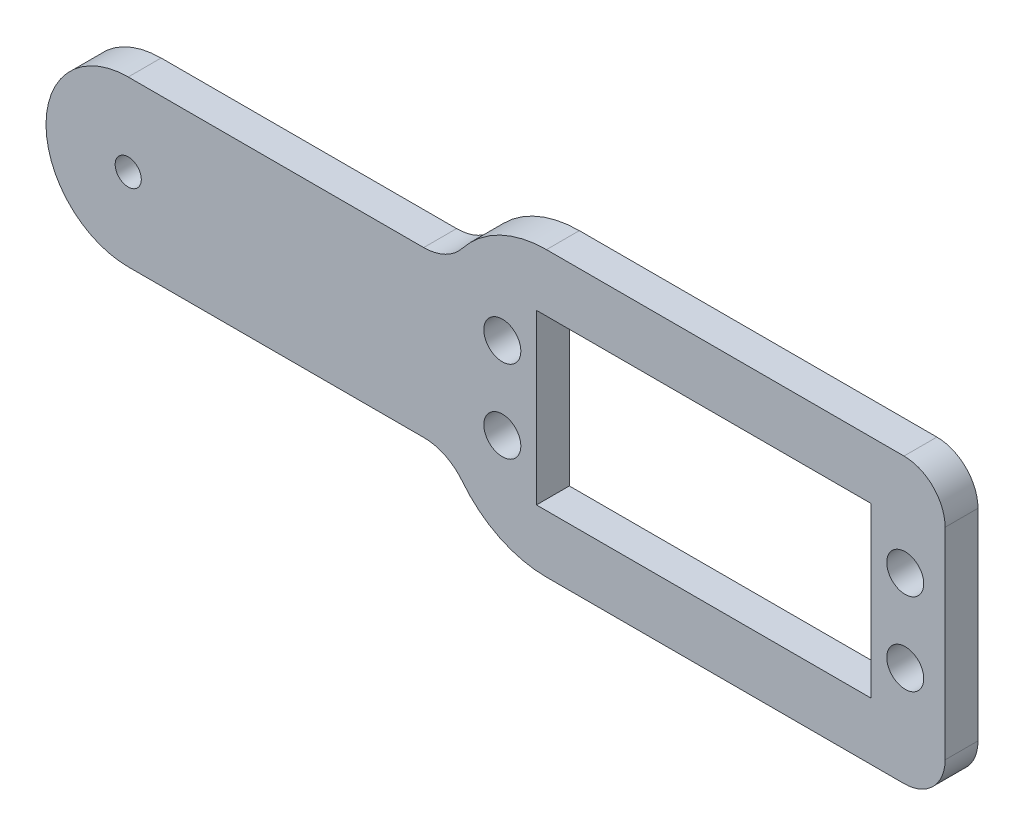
SolidWorks part; units mm, degrees
ref_plane "Front Plane" through (0, 0, 0) normal (0, 0, 1) x (1, 0, 0)
ref_plane "Top Plane" through (0, 0, 0) normal (0, 1, 0) x (1, 0, 0)
ref_plane "Right Plane" through (0, 0, 0) normal (1, 0, 0) x (0, 0, -1)
sketch "Sketch1" plane through (0, 0, 0) normal (0, 0, 1) x (1, 0, 0)
  line L0 (-80, 0) -> (29.35, 0) construction
  line L1 (29.35, -12.25) -> (29.35, 12.25)
  line L2 (24.35, 17.25) -> (-19.134, 17.25)
  line L3 (-34.0651, 10) -> (-70, 10)
  line L4 (-34.0651, -10) -> (-70, -10)
  line L5 (24.35, -17.25) -> (-19.134, -17.25)
  line L32 (-24.5, -5) -> (24.5, 5) construction
  line L33 (20.35, 10.25) -> (-20.35, 10.25)
  line L34 (20.35, 10.25) -> (20.35, -10.25)
  line L35 (20.35, -10.25) -> (-20.35, -10.25)
  line L36 (-20.35, 10.25) -> (-20.35, -10.25)
  line L37 (20.35, 10.25) -> (-20.35, -10.25) construction
  line L38 (20.35, -10.25) -> (-20.35, 10.25) construction
  arc A0 (-29.35, -12.2895) -> (-34.0651, -10) centre (-34.0651, -16) ccw
  arc A1 (29.35, 12.25) -> (24.35, 17.25) centre (24.35, 12.25) ccw
  arc A2 (-19.134, 17.25) -> (-29.35, 12.2895) centre (-19.134, 4.25) ccw
  arc A3 (-29.35, 12.2895) -> (-34.0651, 10) centre (-34.0651, 16) cw
  arc A4 (-70, 10) -> (-70, -10) centre (-70, 0) ccw
  arc A5 (-19.134, -17.25) -> (-29.35, -12.2895) centre (-19.134, -4.25) cw
  arc A6 (29.35, -12.25) -> (24.35, -17.25) centre (24.35, -12.25) cw
  circle A7 centre (-70, 0) radius 1.59
  circle A23 centre (-24.5, -5) radius 2.25
  circle A24 centre (24.5, -5) radius 2.25
  circle A25 centre (24.5, 5) radius 2.25
  circle A26 centre (-24.5, 5) radius 2.25
  point P0 (0, 0)
  point P36 (-70, 0)
  point P92 (0, 0)
  dimension "D5" = 4.5
  dimension "D6" = 5
  dimension "D7" = 10
  dimension "D12" = 3.18
  dimension "D10" = 13
  dimension "D14" = 6
  dimension "D1" = 49
  dimension "D2" = 40.7
  dimension "D3" = 20.5
  dimension "D4" = 10
  dimension "D8" = 7
  dimension "D9" = 9
  dimension "D11" = 70
  dimension "D15" = 9
extrude "Boss-Extrude1" add sketch "Sketch1" along normal blind 4
